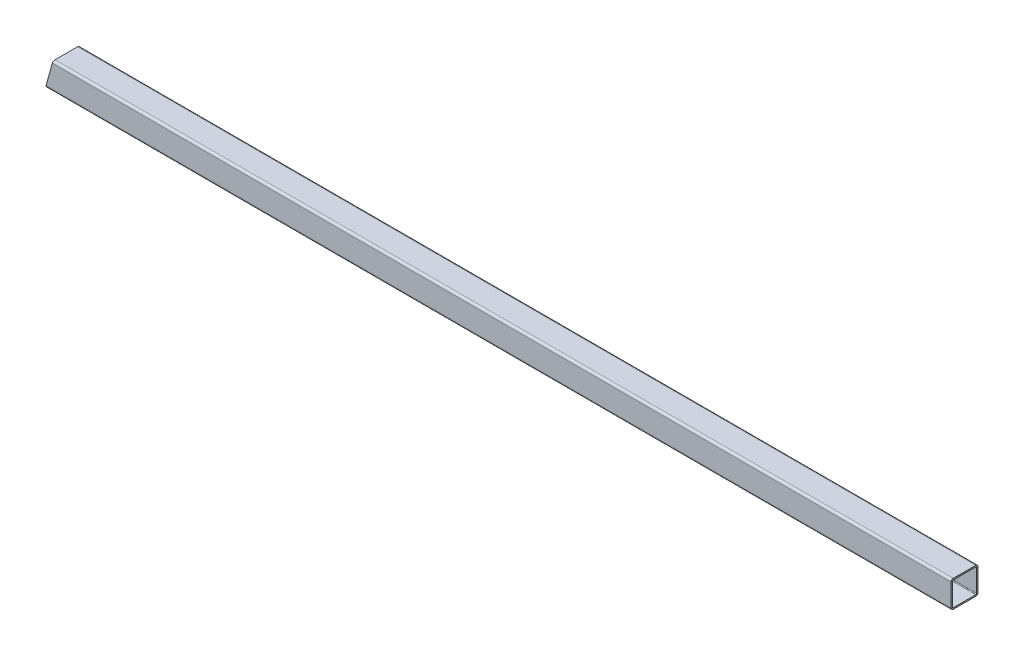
SolidWorks part; units mm, degrees
ref_plane "Front Plane" through (0, 0, 0) normal (0, 0, 1) x (1, 0, 0)
ref_plane "Top Plane" through (0, 0, 0) normal (0, 1, 0) x (1, 0, 0)
ref_plane "Right Plane" through (0, 0, 0) normal (1, 0, 0) x (0, 0, -1)
sketch "Sketch1" plane through (0, 0, 0) normal (1, 0, 0) x (0, 0, -1)
  line L0 (0, 2.54) -> (0, 29.21)
  line L1 (-2.54, 31.75) -> (-29.21, 31.75)
  line L2 (-31.75, 29.21) -> (-31.75, 2.54)
  line L3 (-29.21, 0) -> (-2.54, 0)
  line L4 (-1.651, 2.54) -> (-1.651, 29.21)
  line L5 (-2.54, 30.099) -> (-29.21, 30.099)
  line L6 (-30.099, 29.21) -> (-30.099, 2.54)
  line L7 (-29.21, 1.651) -> (-2.54, 1.651)
  arc A0 (-31.75, 2.54) -> (-29.21, 0) centre (-29.21, 2.54) ccw
  arc A1 (0, 2.54) -> (-2.54, 0) centre (-2.54, 2.54) cw
  arc A2 (0, 29.21) -> (-2.54, 31.75) centre (-2.54, 29.21) ccw
  arc A3 (-31.75, 29.21) -> (-29.21, 31.75) centre (-29.21, 29.21) cw
  arc A4 (-1.651, 29.21) -> (-2.54, 30.099) centre (-2.54, 29.21) ccw
  arc A5 (-30.099, 29.21) -> (-29.21, 30.099) centre (-29.21, 29.21) cw
  arc A6 (-30.099, 2.54) -> (-29.21, 1.651) centre (-29.21, 2.54) ccw
  arc A7 (-1.651, 2.54) -> (-2.54, 1.651) centre (-2.54, 2.54) cw
  point P12 (0, 0)
  point P15 (0, 31.75)
  point P18 (-31.75, 31.75)
  dimension "D3" = 2.54
  dimension "D1" = 31.75
  dimension "D2" = 31.75
  dimension "D4" = 1.651
extrude "Boss-Extrude1" add sketch "Sketch1" along normal blind 1320.8
sketch "Sketch2" plane through (1320.8, 0, 0) normal (1, 0, 0) x (0, 0, -1)
  line L0 (-31.75, 15.875) -> (0, 15.875)
  line L1 (-31.75, 29.21) -> (-31.75, 2.54) construction
  line L2 (0, 2.54) -> (0, 29.21) construction
scale "Scale2" scale about centroid uniform scaling no x scale factor 1 y scale factor 0.4 z scale factor 0.4
sketch "Sketch3" plane through (0, 0, 22.225) normal (0, 0, 1) x (1, 0, 0)
  line L0 (896.4187, 23.3814) -> (892.1267, 7.8444)
  line L1 (892.1267, 7.8444) -> (-50.5879, -33.8396)
  line L2 (-50.5879, -33.8396) -> (60.0442, 138.2037)
  line L3 (60.0442, 138.2037) -> (896.4187, 23.3814)
  line L4 (0, 21.209) -> (0, 10.541) construction
  line L5 (1320.8, 10.541) -> (0, 10.541) construction
  dimension "D1" = 60.0442
  dimension "D2" = 892.1267
  dimension "D3" = 896.4187
  dimension "D4" = 50.5879
  dimension "D5" = 12.8404
  dimension "D6" = 127.6627
  dimension "D7" = 2.6966
  dimension "D8" = 44.3806
extrude "Cut-Extrude1" cut sketch "Sketch3" against normal through all
